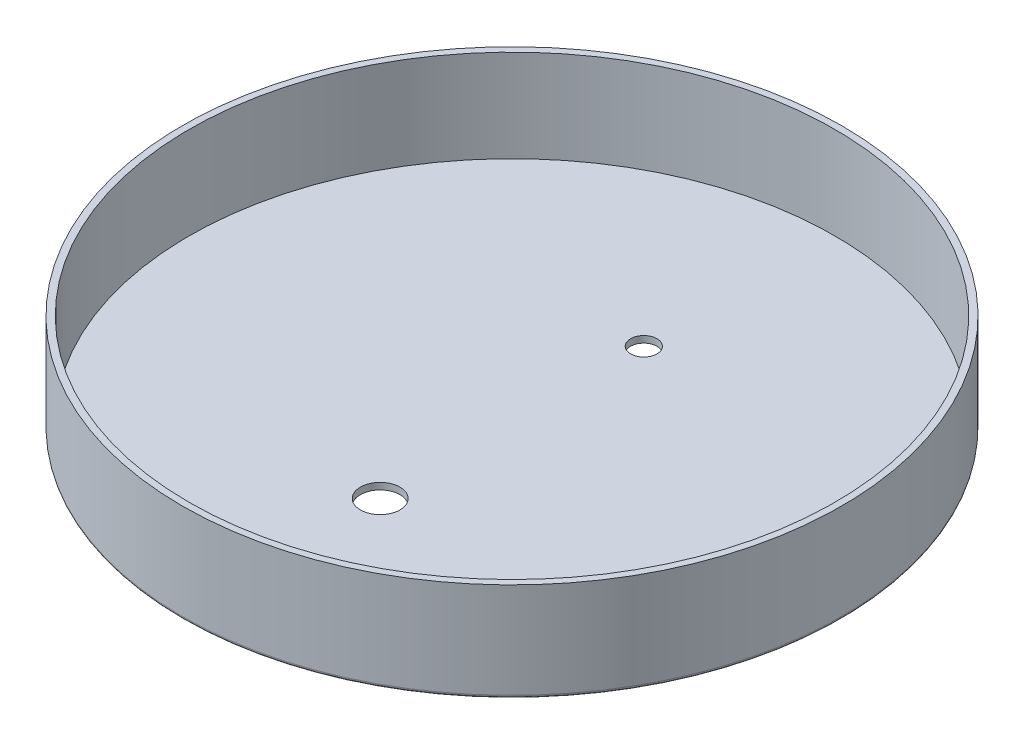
SolidWorks part; units mm, degrees
ref_plane "Plan de face" through (0, 0, 0) normal (0, 0, 1) x (1, 0, 0)
ref_plane "Plan de dessus" through (0, 0, 0) normal (0, 1, 0) x (1, 0, 0)
ref_plane "Plan de droite" through (0, 0, 0) normal (1, 0, 0) x (0, 0, -1)
sketch "Esquisse1" plane through (0, 0, 0) normal (0, 1, 0) x (1, 0, 0)
  circle A0 centre (0, 0) radius 50
  dimension "D1" = 100
extrude "Extrusion1" add sketch "Esquisse1" along normal blind 15
shell "Coque1" thickness 1
fillet "Congé1" radius 0.5 1 edges at (0, 0, 50)
sketch "Esquisse2" plane through (0, 0, 0) normal (0, -1, 0) x (1, 0, 0)
  circle A0 centre (0, -20) radius 2
  circle A1 centre (0, 20) radius 3
  dimension "D1" = 4
  dimension "D2" = 6
  dimension "D4" = 20
  dimension "D3" = 20
extrude "Enlèv. mat.-Extru.1" cut sketch "Esquisse2" against normal blind 10
